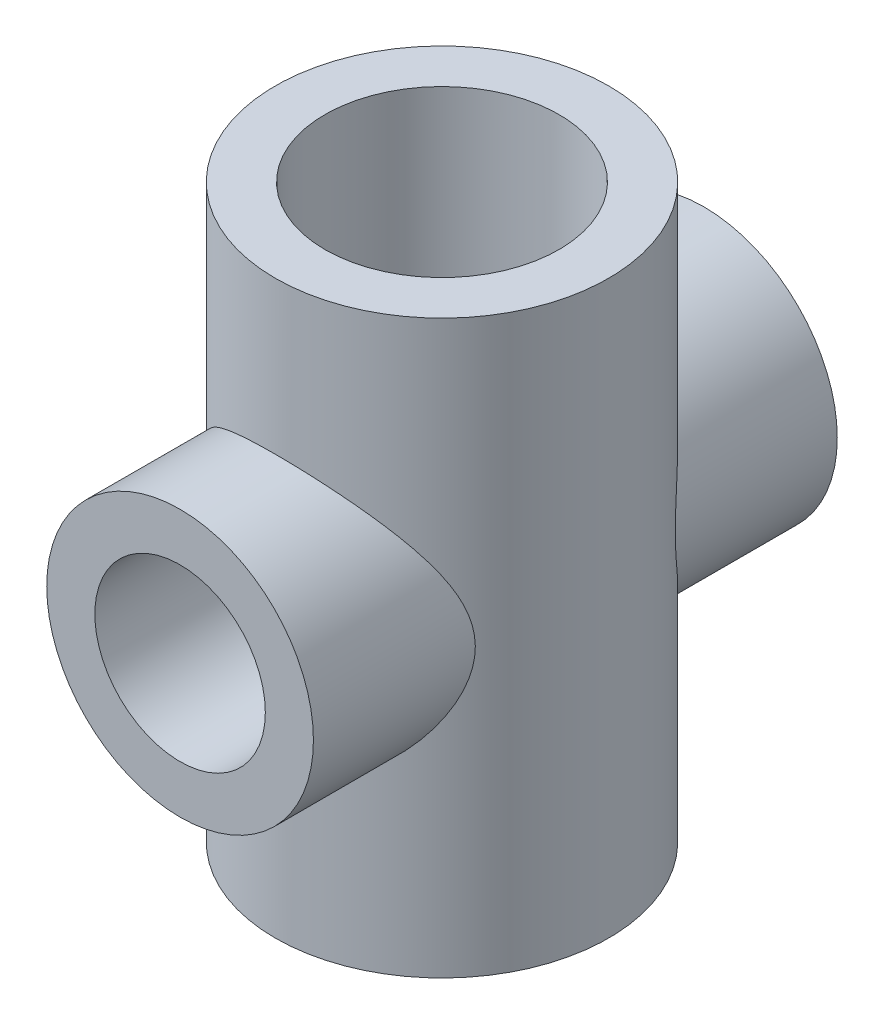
SolidWorks part; units mm, degrees
ref_plane "前视基准面" through (0, 0, 0) normal (0, 0, 1) x (1, 0, 0)
ref_plane "上视基准面" through (0, 0, 0) normal (0, 1, 0) x (1, 0, 0)
ref_plane "右视基准面" through (0, 0, 0) normal (1, 0, 0) x (0, 0, -1)
sketch "草图1" plane through (0, 0, 0) normal (0, 1, 0) x (1, 0, 0)
  circle A0 centre (0, 0) radius 35
  dimension "D1" = 70
extrude "凸台-拉伸1" add sketch "草图1" along normal blind 120
sketch "草图2" plane through (0, 0, 0) normal (0, 0, 1) x (1, 0, 0)
  line L0 (0, 120) -> (0, 0) construction
  line L1 (35, 120) -> (-35, 120) construction
  line L2 (-37.6041, 60) -> (38.3895, 60) construction
  circle A0 centre (0, 60) radius 28
  dimension "D1" = 56
extrude "凸台-拉伸3" add sketch "草图2" along normal mid plane 110 from offset 0
sketch "草图3" plane through (0, 0, 0) normal (0, 1, 0) x (1, 0, 0)
  circle A0 centre (0, 0) radius 24.5715
extrude "切除-拉伸1" cut sketch "草图3" against normal mid plane 297
sketch "草图5" plane through (0, 0, 0) normal (0, 0, 1) x (1, 0, 0)
  circle A0 centre (0, 60) radius 17.9025
extrude "切除-拉伸2" cut sketch "草图5" against normal mid plane 297
